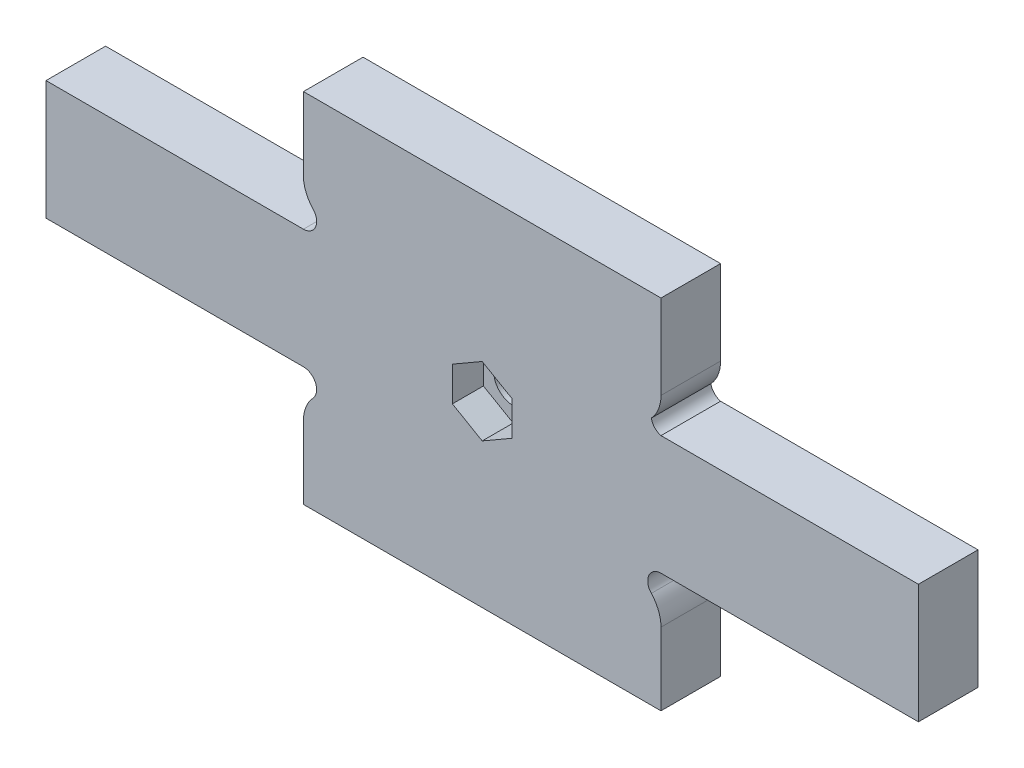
SolidWorks part; units mm, degrees
ref_plane "Plan de face" through (0, 0, 0) normal (0, 0, 1) x (1, 0, 0)
ref_plane "Plan de dessus" through (0, 0, 0) normal (0, 1, 0) x (1, 0, 0)
ref_plane "Plan de droite" through (0, 0, 0) normal (1, 0, 0) x (0, 0, -1)
sketch "Esquisse1" plane through (0, 0, 0) normal (0, 0, 1) x (1, 0, 0)
  line L6 (30, -10) -> (73.2, -10)
  line L7 (73.2, -10) -> (73.2, 10)
  line L8 (73.2, 10) -> (30, 10)
  line L9 (30, 15.8386) -> (30, 30)
  line L10 (30, 30) -> (-30, 30)
  line L11 (-30, 30) -> (-30, 17.374)
  line L12 (-30, 10) -> (-73.2, 10)
  line L13 (-73.2, 10) -> (-73.2, -10)
  line L14 (-73.2, -10) -> (-30, -10)
  line L15 (-30, -17.8386) -> (-30, -30)
  line L16 (-30, -30) -> (30, -30)
  line L17 (30, -30) -> (30, -17.8386)
  arc A0 (30, -17.8386) -> (28.3796, -13.7374) centre (24, -17.8386) ccw
  arc A1 (30, -10) -> (28.3796, -13.7374) centre (30, -12.22) ccw
  arc A2 (28.3796, 11.7374) -> (30, 10) centre (30.5613, 12.1479) ccw
  arc A3 (28.3796, 11.7374) -> (30, 15.8386) centre (24, 15.8386) ccw
  arc A4 (-30, 17.374) -> (-28.3796, 13.7374) centre (-24.0197, 17.8595) ccw
  arc A5 (-30, 10) -> (-28.3796, 13.7374) centre (-30, 12.22) ccw
  arc A6 (-28.3796, -13.7374) -> (-30, -10) centre (-30, -12.22) ccw
  arc A7 (-28.3796, -13.7374) -> (-30, -17.8386) centre (-24, -17.8386) ccw
  dimension "D1" = 60
  dimension "D2" = 20
  dimension "D3" = 20
  dimension "D4" = 30
  dimension "D5" = 60
  dimension "D6" = 30
  dimension "D7" = 10
  dimension "D8" = 10
extrude "Boss.-Extru.1" add sketch "Esquisse1" along normal blind 10
sketch "Esquisse2" plane through (0, 0, 10) normal (0, 0, 1) x (1, 0, 0)
  circle A0 centre (0, 0) radius 3.25
  dimension "D1" = 6.5
extrude "Enlèv. mat.-Extru.1" cut sketch "Esquisse2" against normal blind 10
sketch "Esquisse3" plane through (0, 0, 10) normal (0, 0, 1) x (1, 0, 0)
  line L1 (5, -2.8868) -> (5, 2.8868)
  line L2 (5, 2.8868) -> (0, 5.7735)
  line L3 (0, 5.7735) -> (-5, 2.8868)
  line L4 (-5, 2.8868) -> (-5, -2.8868)
  line L5 (-5, -2.8868) -> (0, -5.7735)
  line L6 (0, -5.7735) -> (5, -2.8868)
  circle A0 centre (0, 0) radius 5 construction
  dimension "D1" = 10
extrude "Enlèv. mat.-Extru.2" cut sketch "Esquisse3" against normal blind 5.2
